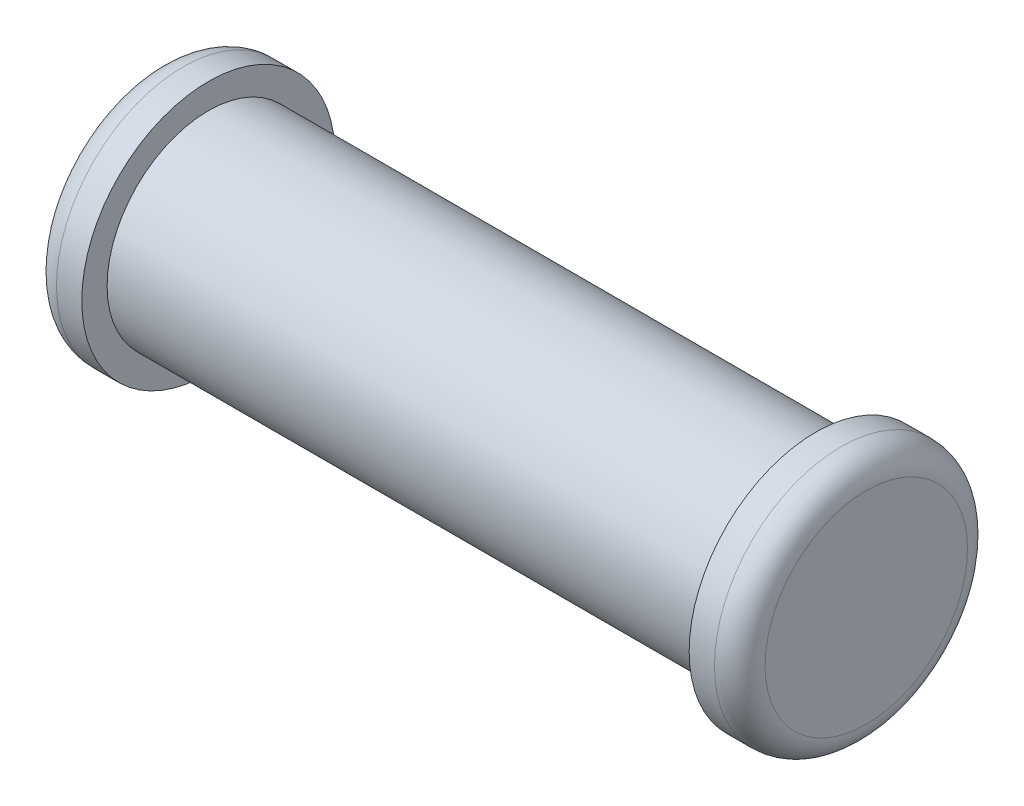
SolidWorks part; units mm, degrees
ref_plane "Front Plane" through (0, 0, 0) normal (0, 0, 1) x (1, 0, 0)
ref_plane "Top Plane" through (0, 0, 0) normal (0, 1, 0) x (1, 0, 0)
ref_plane "Right Plane" through (0, 0, 0) normal (1, 0, 0) x (0, 0, -1)
sketch "Sketch1" plane through (0, 0, 0) normal (1, 0, 0) x (0, 0, -1)
  circle A0 centre (0, 0) radius 2
  dimension "D1" = 4
extrude "Boss-Extrude1" add sketch "Sketch1" along normal blind 12
sketch "Sketch2" plane through (0, 0, 0) normal (-1, 0, 0) x (0, 0, 1)
  circle A0 centre (0, 0) radius 2.5
  dimension "D1" = 5
extrude "Boss-Extrude2" add sketch "Sketch2" along normal blind 1
fillet "Fillet1" radius 0.5 1 edges at (-1, 0, 2.5)
ref_plane "Plane1" through (6, 0, 0) normal (1, 0, 0) x (0, 0, -1)
mirror "Mirror1" about plane through (6, 0, 0) normal (1, 0, 0) of "Boss-Extrude2", "Fillet1"
